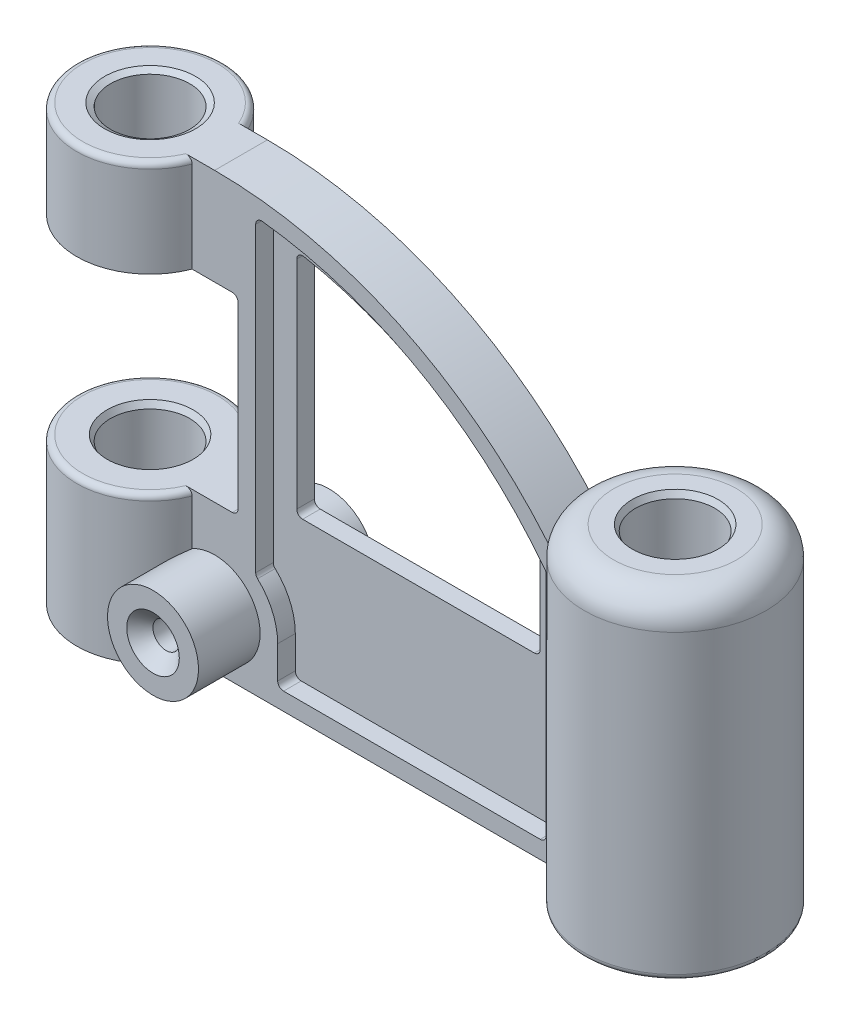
SolidWorks part; units mm, degrees
ref_plane "Front Plane" through (0, 0, 0) normal (0, 0, 1) x (1, 0, 0)
ref_plane "Top Plane" through (0, 0, 0) normal (0, 1, 0) x (1, 0, 0)
ref_plane "Right Plane" through (0, 0, 0) normal (1, 0, 0) x (0, 0, -1)
sketch "Sketch1" plane through (0, 0, 0) normal (0, 1, 0) x (1, 0, 0)
  line L0 (0, 0) -> (89.422, 0) construction
  line L1 (23.3238, -9) -> (149.3352, -9)
  line L2 (23.3238, 9) -> (149.3352, 9)
  line L3 (0, 9) -> (179, 9) construction
  line L4 (0, -9) -> (179, -9) construction
  line L5 (0, 0) -> (179, 0) construction
  circle A0 centre (0, 0) radius 13.5
  arc A1 (23.3238, 9) -> (23.3238, -9) centre (0, 0) ccw
  arc A2 (149.3352, -9) -> (149.3352, 9) centre (179, 0) ccw
  circle A3 centre (179, 0) radius 13.5
  dimension "D1" = 50
  dimension "D" = 27
  dimension "B" = 62
  dimension "D2" = 9
  dimension "C" = 179
  dimension "D3" = 9
extrude "Boss-Extrude1" add sketch "Sketch1" along normal blind 148
sketch "Sketch2" plane through (0, 0, 9) normal (0, 0, 1) x (1, 0, 0)
  line L0 (13.5, 148) -> (-13.5, 148) construction
  line L1 (13.5, 148) -> (-13.5, 148) construction
  line L2 (192.5, 148) -> (165.5, 148) construction
  line L3 (192.5, 148) -> (165.5, 148) construction
  line L4 (0, 148) -> (0, -18.572) construction
  line L5 (179, 148) -> (179, -26.9551) construction
  line L6 (31, 148) -> (31, 0) construction
  line L7 (23.3238, 0) -> (149.3352, 0) construction
  line L8 (23.3238, 148) -> (149.3352, 148) construction
  line L9 (149.3352, 148) -> (149.3352, 0) construction
  line L10 (149.3352, 88.8863) -> (149.3352, 0) construction
  line L11 (149.3352, 0) -> (23.3238, 0) construction
  line L12 (23.3238, 0) -> (23.3238, 148) construction
  line L13 (23.3238, 148) -> (31, 148)
  line L14 (149.3352, 88.8863) -> (149.3352, 171.4438)
  line L15 (149.3352, 171.4438) -> (23.3238, 171.4438)
  line L16 (23.3238, 171.4438) -> (23.3238, 148)
  arc A0 (31, 148) -> (149.3352, 88.8863) centre (31, 0) cw
  dimension "D1" = 148
sketch "Sketch3" plane through (0, 0, 0) normal (0, 0, 1) x (1, 0, 0)
  line L0 (23.3238, 0) -> (149.3352, 0) construction
  line L1 (149.3352, 0) -> (210, 0) construction
  line L2 (23.3238, 0) -> (149.3352, 0) construction
  line L3 (149.3352, 0) -> (210, 0) construction
  line L4 (179.6676, 0) -> (179, 113) construction
  line L5 (179, 148) -> (179, -26.9551) construction
  line L6 (210, 113) -> (149.3352, 113)
  line L7 (210, 0) -> (210, 148) construction
  line L8 (149.3352, 148) -> (149.3352, 0) construction
  line L9 (149.3352, 113) -> (149.3352, 213)
  line L10 (149.3352, 213) -> (210, 213)
  line L11 (210, 213) -> (210, 113)
  dimension "D1" = 100
  dimension "Y" = 113
extrude "Cut-Extrude2" cut sketch "Sketch2" against normal through all
extrude "Cut-Extrude3" cut sketch "Sketch3" against normal through all and the other way through all
sketch "Sketch4" plane through (0, 113, 0) normal (0, 1, 0) x (1, 0, 0)
  circle A1 centre (179, 0) radius 31
  circle A2 centre (179, 0) radius 13.5 construction
  circle A3 centre (179, 0) radius 13.5
extrude "Boss-Extrude2" add sketch "Sketch4" against normal up to next
sketch "Sketch5" plane through (0, 0, 9) normal (0, 0, 1) x (1, 0, 0)
  line L0 (192.5, 113) -> (165.5, 113) construction
  line L1 (192.5, 113) -> (165.5, 113)
  line L2 (13.5, 148) -> (-13.5, 148) construction
  line L3 (13.5, 148) -> (-13.5, 148)
  line L4 (0, 148) -> (0, 0) construction
  line L5 (179, 113) -> (179, 0) construction
  line L6 (32, 142) -> (32, 6)
  line L7 (144, 85.9942) -> (144, 6)
  line L13 (23.3238, 142) -> (31, 142)
  line L14 (32, 142) -> (31, 142)
  line L15 (-25, 0) -> (23.3238, 0) construction
  line L16 (23.3238, 6) -> (149.3352, 6)
  line L17 (32, 6) -> (144, 6)
  line L18 (149.3352, 0) -> (210, 0) construction
  arc A5 (144.5378, 85.2828) -> (31, 142) centre (31, 0) ccw
  arc A6 (144, 85.9942) -> (31, 142) centre (31, 0) ccw
  dimension "D1" = 32
  dimension "D2" = 35
  dimension "D3" = 6
  dimension "D4" = 6
extrude "Cut-Extrude4" [suppressed] cut sketch "Sketch5" against normal blind 6 contours A6 L14 L6 L17 L7
mirror "Mirror1" [suppressed] about plane through (0, 0, 0) normal (0, 0, 1)
chamfer "Chamfer1" [suppressed] distance 2 angle 45
fillet "Fillet1" [suppressed] radius 7
fillet "Fillet2" [suppressed] radius 2
sketch "Sketch7" plane through (0, 0, 0) normal (0, 0, 1) x (1, 0, 0)
  line L0 (31, 0) -> (31, 19) construction
  line L1 (23.3238, 0) -> (149.3352, 0) construction
  line L2 (192.5, 113) -> (165.5, 113) construction
  line L3 (192.5, 113) -> (165.5, 113) construction
  line L4 (179, 113) -> (179, 0) construction
  line L5 (149.3352, 0) -> (210, 0) construction
  circle A0 centre (31, 19) radius 15.5
  dimension "D2" = 31
  dimension "D1" = 19
extrude "Boss-Extrude3" add sketch "Sketch7" along normal mid plane 60
hole_wizard "CSK for M8 Hex Socket Countersunk Cap Screw1" positions "Sketch9" profile "Sketch8" countersink size "M8" standard "ISO"
sketch "Sketch9" plane through (0, 0, 30) normal (0, 0, 1) x (1, 0, 0)
  circle A0 centre (31, 19) radius 15.5 construction
  point P0 (31, 19)
sketch "Sketch8" plane through (31, 19, 30) normal (1, 0, 0) x (0, -1, 0)
  line L0 (0, 0) -> (0, 61)
  line L1 (0, 61) -> (4.5, 61)
  line L2 (4.5, 61) -> (4.5, 4.46)
  line L3 (4.5, 4.46) -> (8.96, 0)
  line L5 (8.96, 0) -> (0, 0)
  line L6 (-4.5, 4.46) -> (-8.96, 0) construction
  line L11 (0, -6.35) -> (0, 107.95) construction
  dimension "Thru Hole Dia." = 9
  dimension "Thru Hole Depth" = 61
  dimension "Near C'Sink Dia." = 17.92
  dimension "Near C'Sink Angle" = 90
sketch "Sketch10" plane through (0, 0, 0) normal (0, 0, 1) x (1, 0, 0)
  line L0 (-25, 0) -> (23.3238, 0) construction
  line L1 (-25, 115) -> (39, 115)
  line L2 (-25, 115) -> (-25, 50)
  line L3 (-25, 50) -> (39, 50)
  line L4 (39, 115) -> (39, 50)
  line L5 (-25, 148) -> (-25, 0) construction
  line L6 (31, 19) -> (31, 148) construction
  line L7 (23.3238, 148) -> (31, 148) construction
  dimension "D1" = 50
  dimension "D2" = 65
  dimension "D3" = 8
extrude "Cut-Extrude5" cut sketch "Sketch10" against normal through all and the other way through all
sketch "Sketch11" plane through (0, 0, 9) normal (0, 0, 1) x (1, 0, 0)
  line L0 (192.5, 113) -> (165.5, 113) construction
  line L1 (192.5, 113) -> (165.5, 113) construction
  line L2 (179, 113) -> (179, 0) construction
  line L3 (149.3352, 0) -> (210, 0) construction
  line L4 (144, 85.9942) -> (144, 6)
  line L5 (31, 19) -> (31, 148) construction
  line L8 (45, 115) -> (45, 50)
  line L9 (45, 141.3082) -> (45, 35.3172)
  line L10 (52.5, 19) -> (52.5, 6)
  line L11 (23.3238, 6) -> (149.3352, 6)
  line L12 (52.5, 6) -> (144, 6)
  line L13 (23.3238, 148) -> (31, 148) construction
  arc A2 (144.5378, 85.2828) -> (31, 142) centre (31, 0) ccw
  arc A3 (144, 85.9942) -> (45, 141.3082) centre (31, 0) ccw
  arc A5 (20.3524, 0.3217) -> (20.3524, 37.6783) centre (31, 19) ccw
  arc A6 (52.5, 19) -> (45, 35.3172) centre (31, 19) ccw
  dimension "D1" = 35
  dimension "D2" = 148
  dimension "D3" = 6
  dimension "D4" = 6
  dimension "D5" = 6
  dimension "D6" = 6
extrude "Cut-Extrude6" cut sketch "Sketch11" against normal blind 6
mirror "Mirror2" about plane through (0, 0, 0) normal (0, 0, 1) of "Cut-Extrude6"
sketch "Sketch12" plane through (0, 0, 3) normal (0, 0, 1) x (1, 0, 0)
  line L4 (53, 54) -> (136, 54)
  line L5 (23.3238, 0) -> (149.3352, 0) construction
  line L8 (60.5, 14) -> (136, 14)
  line L9 (136, 14) -> (136, 83.2526)
  line L10 (53, 132.1817) -> (53, 38.6532)
  line L11 (60.5, 19) -> (60.5, 14)
  line L12 (60.5, 14) -> (136, 14) construction
  line L13 (136, 54) -> (136, 83.2526)
  line L14 (53, 132.1817) -> (53, 54)
  line L15 (60.5, 19) -> (60.5, 14) construction
  arc A4 (136, 83.2526) -> (53, 132.1817) centre (31, 0) ccw
  arc A5 (60.5, 19) -> (53, 38.6532) centre (31, 19) ccw
  arc A6 (136, 83.2526) -> (53, 132.1817) centre (31, 0) ccw
  arc A7 (60.5, 19) -> (53, 38.6532) centre (31, 19) ccw construction
  dimension "Z" = 54
  dimension "D1" = 8
extrude "Cut-Extrude7" cut sketch "Sketch12" against normal through all and the other way through all
fillet "Fillet3" radius 10 1 edges at (179, 113, -31)
fillet "Fillet4" radius 2 17 edges at (144, 6, -6) (45, 35.3172, -6) (52.5, 6, -6) (45, 141.3082, -6) (144, 85.9942, -6) (136, 54, 0) (136, 83.2526, 0) (53, 132.1817, 0) (53, 54, 0) (144, 6, 6) (144, 85.9942, 6) (45, 141.3082, 6) (45, 35.3172, 6) (52.5, 6, 6) (210, 0, 0) (-25, 50, 0) (-25, 148, 0)
chamfer "Chamfer2" distance 2 angle 30 6 edges at (0, 115, 13.5) (179, 0, 13.5) (179, 113, -13.5) (0, 0, 13.5) (0, 50, -13.5) (0, 148, 13.5)
fillet "Fillet5" radius 2 2 edges at (39, 50, 0) (39, 115, 0)
equation "\"A\"= 148"
equation "\"B\"= 62"
equation "\"C\"= 179"
equation "\"D\"= 27"
equation "\"Y\"= 1.5 * \"B\" + 20"
equation "\"Z\"= 2*\"D\""
